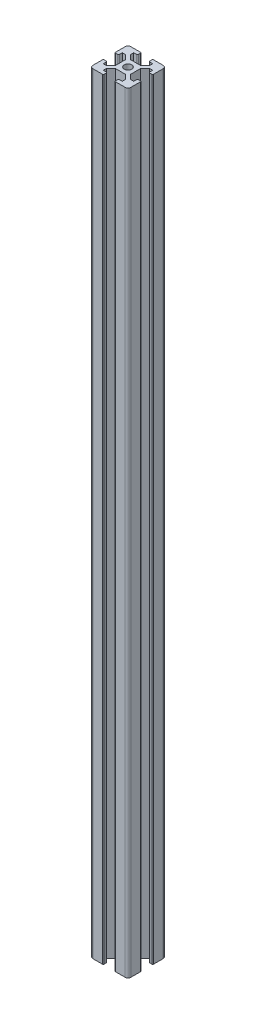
SolidWorks part; units mm, degrees
ref_plane "Alzado" through (0, 0, 0) normal (0, 0, 1) x (1, 0, 0)
ref_plane "Planta" through (0, 0, 0) normal (0, 1, 0) x (1, 0, 0)
ref_plane "Vista lateral" through (0, 0, 0) normal (1, 0, 0) x (0, 0, -1)
sketch "Croquis1" plane through (0, 0, 0) normal (0, 1, 0) x (1, 0, 0)
  line L0 (-10, 10) -> (-3, 10)
  line L1 (-2.5858, -4) -> (2.5858, -4)
  line L2 (-4, -2.5858) -> (-4, 2.5858)
  line L3 (-2.5858, 4) -> (2.5858, 4)
  line L4 (4, -2.5858) -> (4, 2.5858)
  line L5 (-4, -4) -> (4, 4) construction
  line L6 (-1.4142, 1.4142) -> (4, -4) construction
  line L11 (-10, -10) -> (10, 10) construction
  line L12 (5, 8) -> (5, 6.4142)
  line L13 (-3, 10) -> (-3, 8)
  line L20 (-8, 5) -> (-6.4142, 5)
  line L21 (-5, 8) -> (-5, 6.4142)
  line L30 (-3, 8) -> (-5, 8)
  line L31 (-10, 3) -> (-8, 3)
  line L32 (-8, 3) -> (-8, 5)
  line L33 (0, 14.0655) -> (0, -11.7776) construction
  line L34 (-14.7196, 0) -> (20.6254, 0) construction
  line L35 (-2.5858, 4) -> (-5, 6.4142)
  line L36 (-4, 2.5858) -> (-6.4142, 5)
  line L37 (3, 8) -> (5, 8)
  line L38 (3, 10) -> (3, 8)
  line L39 (10, 3) -> (8, 3)
  line L40 (-1.4142, 1.4142) -> (10, -10) construction
  line L41 (8, 3) -> (8, 5)
  line L42 (8, 5) -> (6.4142, 5)
  line L43 (4, 2.5858) -> (6.4142, 5)
  line L44 (2.5858, 4) -> (5, 6.4142)
  line L45 (10, -3) -> (8, -3)
  line L46 (8, -3) -> (8, -5)
  line L47 (8, -5) -> (6.4142, -5)
  line L48 (4, -2.5858) -> (6.4142, -5)
  line L49 (5, -8) -> (5, -6.4142)
  line L50 (2.5858, -4) -> (5, -6.4142)
  line L51 (3, -8) -> (5, -8)
  line L52 (3, -10) -> (3, -8)
  line L53 (-3, -10) -> (-3, -8)
  line L54 (-3, -8) -> (-5, -8)
  line L55 (-10, -3) -> (-8, -3)
  line L56 (-8, -3) -> (-8, -5)
  line L57 (-8, -5) -> (-6.4142, -5)
  line L58 (-4, -2.5858) -> (-6.4142, -5)
  line L59 (-2.5858, -4) -> (-5, -6.4142)
  line L60 (-5, -8) -> (-5, -6.4142)
  line L63 (-10, -3) -> (-10, -10)
  line L66 (3, 10) -> (10, 10)
  line L67 (-10, 10) -> (-10, 3)
  line L68 (10, 10) -> (10, 3)
  line L69 (-10, -10) -> (-3, -10)
  line L70 (3, -10) -> (10, -10)
  line L71 (10, -10) -> (10, -3)
  circle A0 centre (0, 0) radius 2
  point P0 (0, 0)
  dimension "D3" = 4
  dimension "D2" = 8
  dimension "D4" = 20
  dimension "D5" = 20
  dimension "D14" = 2
  dimension "D16" = 2
extrude "Saliente-Extruir1" add sketch "Croquis1" along normal blind 405
fillet "Redondeo1" radius 1.5 4 edges at (10, 202.5, 10) (-10, 202.5, 10) (-10, 202.5, -10) (10, 202.5, -10)
fillet "Redondeo2" radius 0.5 16 edges at (3, 202.5, 10) (3, 202.5, 8) (-3, 202.5, 10) (-3, 202.5, 8) (-10, 202.5, 3) (-8, 202.5, 3) (10, 202.5, 3) (8, 202.5, 3) (-10, 202.5, -3) (-8, 202.5, -3) (-3, 202.5, -8) (3, 202.5, -8) (8, 202.5, -3) (10, 202.5, -3) (3, 202.5, -10) (-3, 202.5, -10)
